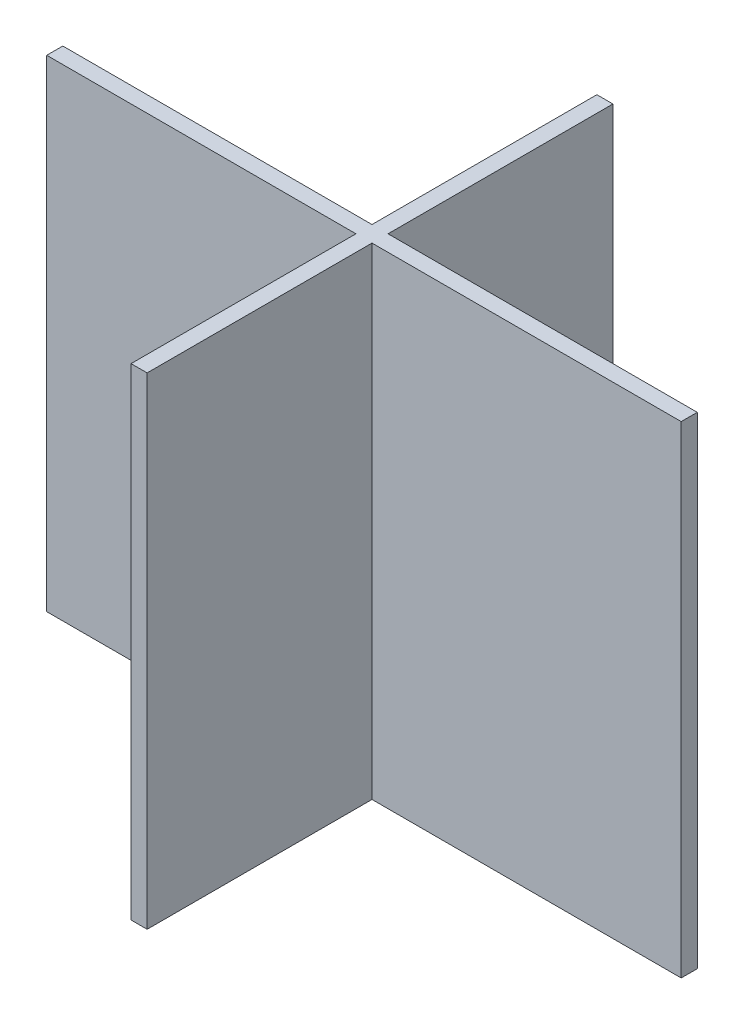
SolidWorks part; units mm, degrees
ref_plane "前视基准面" through (0, 0, 0) normal (0, 0, 1) x (1, 0, 0)
ref_plane "上视基准面" through (0, 0, 0) normal (0, 1, 0) x (1, 0, 0)
ref_plane "右视基准面" through (0, 0, 0) normal (1, 0, 0) x (0, 0, -1)
other "Configuration Table"
sketch "草图1" plane through (0, 0, 0) normal (0, 1, 0) x (1, 0, 0)
  line L1 (-39.5, 1) -> (39.5, 1)
  line L2 (-39.5, 1) -> (-39.5, -1)
  line L3 (-39.5, -1) -> (39.5, -1)
  line L4 (39.5, 1) -> (39.5, -1)
  line L5 (0, -1) -> (0, 1) construction
  line L6 (-39.5, 0) -> (39.5, 0) construction
  line L7 (-1, 29) -> (1, 29)
  line L8 (-1, 29) -> (-1, -29)
  line L9 (-1, -29) -> (1, -29)
  line L10 (1, 29) -> (1, -29)
  line L11 (0, -29) -> (0, 29) construction
  line L12 (-1, 0) -> (1, 0) construction
  point P0 (0, 0)
  point P4 (0, 0)
  dimension "D1" = 2
  dimension "D2" = 2
  dimension "D3" = 79
  dimension "D4" = 58
extrude "凸台-拉伸1" add sketch "草图1" along normal blind 60 contours L8 L1 L2 L3 | L10 L3 L8 L9 | L10 L7 L8 L1 | L10 L1 L8 L3 | L1 L10 L3 L4
